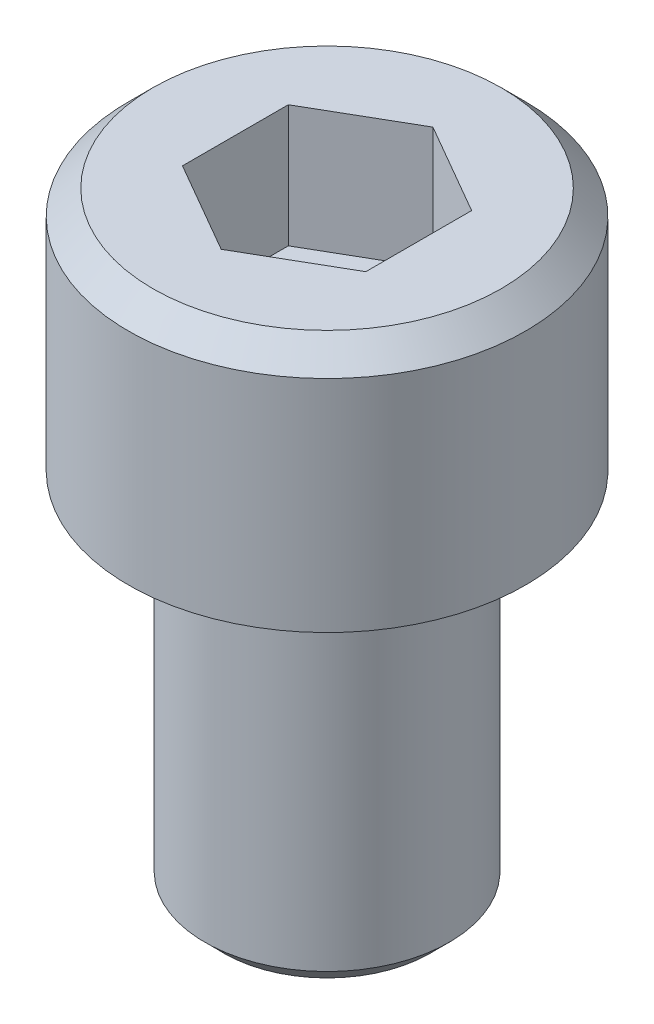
SolidWorks part; units mm, degrees
ref_plane "Front" through (0, 0, 0) normal (0, 0, 1) x (1, 0, 0)
ref_plane "Top" through (0, 0, 0) normal (0, 1, 0) x (1, 0, 0)
ref_plane "Right" through (0, 0, 0) normal (1, 0, 0) x (0, 0, -1)
sketch "Sketch1" plane through (0, 0, 0) normal (0, 0, 1) x (1, 0, 0)
  line L0 (0, 20) -> (5.7, 20)
  line L1 (6.5, 19.2) -> (6.5, 12)
  line L2 (6.5, 12) -> (4, 12)
  line L3 (4, 12) -> (4, 0)
  line L4 (4, 0) -> (0, 0)
  line L5 (0, 0) -> (0, 20)
  line L6 (0, 0) -> (0, 27.1815) construction
  line L7 (5.7, 20) -> (6.5, 19.2)
  point P1 (6.5, 20)
  point P6 (4, 0)
  dimension "D1" = 13
  dimension "D2" = 12
  dimension "D3" = 8
  dimension "D4" = 8
  dimension "D5" = 0.8
  dimension "D6" = 45
revolve "Revolve1" add sketch "Sketch1" angle 360 about L6
sketch "Sketch2" plane through (0, 20, 0) normal (0, 1, 0) x (0, 0, 1)
  line L1 (-1.7321, 3) -> (-3.4641, 0)
  line L2 (-3.4641, 0) -> (-1.7321, -3)
  line L3 (-1.7321, -3) -> (1.7321, -3)
  line L4 (1.7321, -3) -> (3.4641, 0)
  line L5 (3.4641, 0) -> (1.7321, 3)
  line L6 (1.7321, 3) -> (-1.7321, 3)
  circle A0 centre (0, 0) radius 3 construction
  dimension "D1" = 6
extrude "Cut-Extrude1" cut sketch "Sketch2" against normal blind 4
chamfer "Chamfer1" distance 0.625 angle 45 1 edges at (0, 0, -4)
